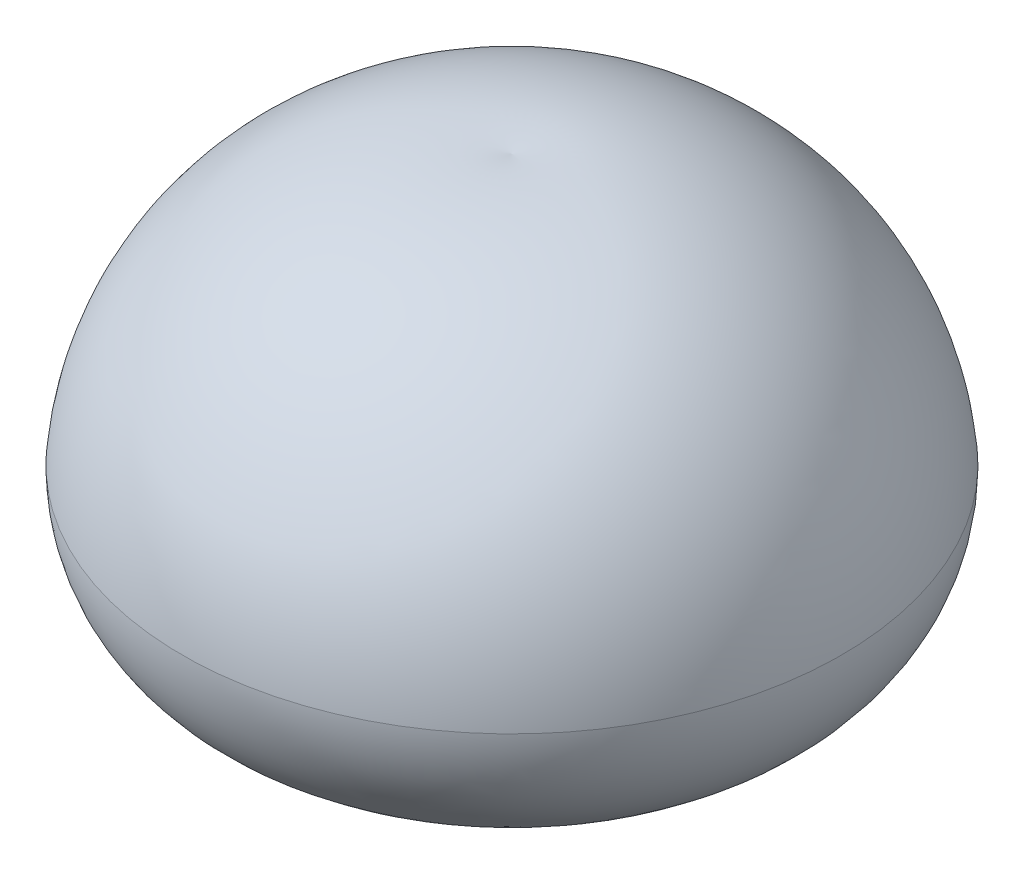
SolidWorks part; units mm, degrees
ref_plane "前视基准面" through (0, 0, 0) normal (0, 0, 1) x (1, 0, 0)
ref_plane "上视基准面" through (0, 0, 0) normal (0, 1, 0) x (1, 0, 0)
ref_plane "右视基准面" through (0, 0, 0) normal (1, 0, 0) x (0, 0, -1)
sketch "草图1" plane through (0, 0, 0) normal (0, 0, 1) x (1, 0, 0)
  line L0 (0, 0) -> (0, 688) construction
  line L1 (0, 688) -> (-285, 688) construction
  line L2 (-285, 688) -> (-285, 1838) construction
  line L3 (-285, 1838) -> (-285, 2068) construction
  line L4 (-285, 2068) -> (-1550, 2068) construction
  line L5 (-1550, 2068) -> (-285, 1838) construction
  line L6 (-285, 688) -> (710.9292, 1263) construction
  line L7 (-285, 688) -> (-1417.5289, 887.6954) construction
  line L8 (-1417.5289, 887.6954) -> (-1644.0347, 927.6345) construction
  line L9 (-1644.0347, 927.6345) -> (-1863.6996, -318.1473) construction
  line L10 (-1417.5289, 887.6954) -> (-1863.6996, -318.1473) construction
  line L11 (710.9292, 1263) -> (910.1151, 1378) construction
  line L12 (910.1151, 1378) -> (277.6151, 2473.5221) construction
  line L13 (277.6151, 2473.5221) -> (710.9292, 1263) construction
  line L14 (710.9292, 1263) -> (-556.4466, 1046.4738) construction
  line L15 (710.9292, 1263) -> (1144.2434, 52.4779) construction
  line L16 (-556.4466, 1046.4738) -> (632.2646, 1479.1293) construction
  line L17 (-1417.5289, 887.6954) -> (-307.4824, 238.9106) construction
  line L18 (632.2646, 1479.1293) -> (710.9292, 1263) construction
  line L19 (-2703.268, 887.6954) -> (-1417.5289, 887.6954) construction
  line L20 (-2703.268, 887.6954) -> (-1458.6726, 1113.9855)
  line L21 (-1458.6726, 1113.9855) -> (-1417.5289, 887.6954) construction
  line L22 (-1417.5289, 887.6954) -> (-1496.1935, 671.5661) construction
  line L23 (-1496.1935, 671.5661) -> (-307.4824, 238.9106) construction
  line L24 (710.9292, 1263) -> (511.7434, 1148) construction
  line L25 (511.7434, 1148) -> (1144.2434, 52.4779) construction
  line L26 (710.9292, 1263) -> (1919.1287, 1702.7487) construction
  line L27 (710.9292, 1263) -> (826.9874, 1064.4288) construction
  line L28 (826.9874, 1064.4288) -> (1919.1287, 1702.7487) construction
  line L29 (-1417.5289, 887.6954) -> (-1191.0231, 847.7563)
  line L30 (-1191.0231, 847.7563) -> (-971.3582, 2093.5381) construction
  line L31 (-971.3582, 2093.5381) -> (-1417.5289, 887.6954) construction
  line L33 (0, 2225.9857) -> (0, 3097.704)
  circle A0 centre (-285, 688) radius 1150 construction
  arc A3 (1144.2434, 52.4779) -> (1919.1287, 1702.7487) centre (710.9292, 1263) ccw construction
  arc A4 (-2703.268, 887.6954) -> (-307.4824, 238.9106) centre (-1417.5289, 887.6954) ccw
  arc A5 (0, 3097.704) -> (-2703.268, 887.6954) centre (-285, 688) ccw
  arc A7 (-556.4466, 1046.4738) -> (-306.1866, 238.8476) centre (-285, 688) ccw
  arc A8 (-120.7566, 2243.5221) -> (-556.4466, 1046.4738) centre (710.9292, 1263) ccw
  arc A10 (1144.2434, 52.4779) -> (416.2756, 2086.1551) centre (-285, 688) ccw construction
  arc A11 (0, 2225.9857) -> (-120.7566, 2243.5221) centre (-285, 688) ccw
  dimension "D1" = 688
  dimension "D2" = 285
  dimension "D3" = 1150
  dimension "D4" = 230
  dimension "D5" = 1265
  dimension "D6" = 80
  dimension "D7" = 60
  dimension "D8" = 180
  dimension "D9" = 80
  dimension "D10" = 80
  dimension "D11" = 180
  dimension "D12" = 69.695
  dimension "D13" = 2703.268
revolve "旋转2" add sketch "草图1" angle 360 about L33
